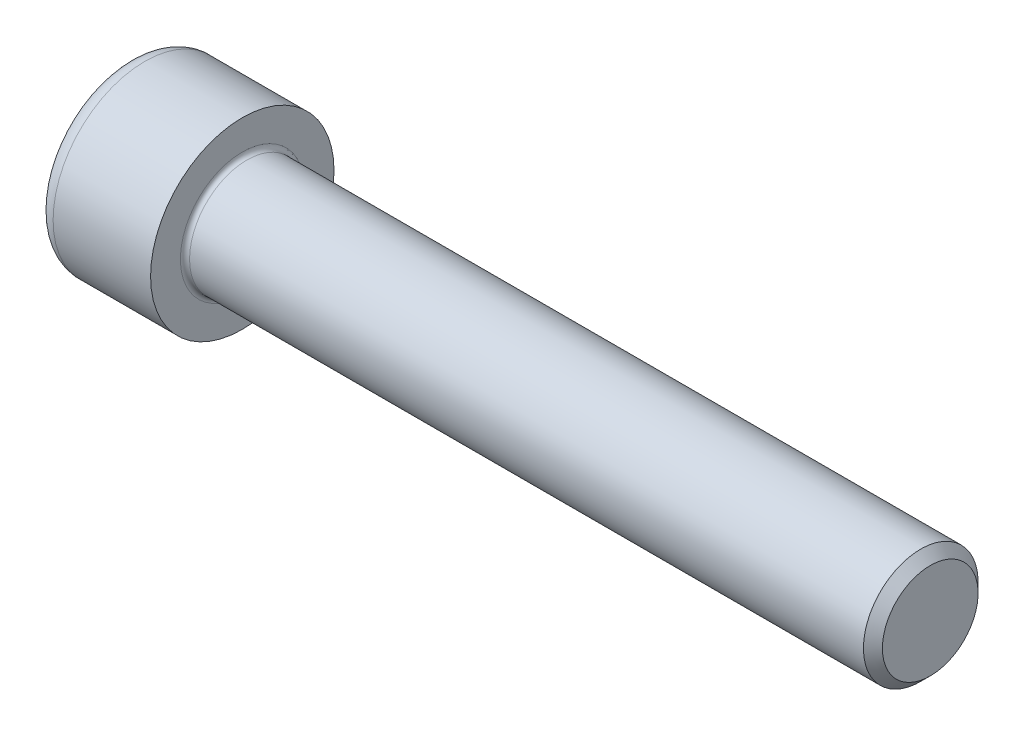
SolidWorks part; units mm, degrees
ref_plane "Plane1" through (0, 0, 0) normal (0, 0, 1) x (1, 0, 0)
ref_plane "Plane2" through (0, 0, 0) normal (0, 1, 0) x (1, 0, 0)
ref_plane "Plane3" through (0, 0, 0) normal (1, 0, 0) x (0, 0, -1)
revolve "Base-Revolve" add sketch "BodySke"
sketch "BodySke" plane through (0, 0, 0) normal (0, 0, 1) x (1, 0, 0)
  line L0 (0, 0) -> (0, 8)
  line L1 (0, 8) -> (10, 8)
  line L2 (10, 8) -> (10, 5)
  line L3 (10, 5) -> (69.172, 5)
  line L4 (70, 4.172) -> (70, 0)
  line L5 (70, 0) -> (0, 0)
  line L6 (-31.75, 0) -> (127, 0) construction
  line L8 (70, 4.172) -> (69.172, 5)
  line L10 (70, -4.172) -> (69.172, -5) construction
  line L11 (11.5, 9.525) -> (11.5, 3.175) construction
  line L12 (10, 9.525) -> (10, 3.175) construction
  line L13 (10, 9.525) -> (10, 3.175) construction
  dimension "Diameter" = 10
  dimension "Head_ht" = 10
  dimension "Length" = 60
  dimension "Body_ch_ang" = 45
  dimension "Head_dia" = 16
  dimension "Minor_dia" = 8.344
  dimension "Advance" = 1.5
  dimension "Thread_nom" = 60
  dimension "Thread_length" = 60
fillet "Fillet1" radius 0.4 1 edges at (10, 0, 5)
fillet "Fillet2" radius 1.5 1 edges at (0, 0, 8)
sketch "Sketch2" plane through (0, 0, 0) normal (0, 0, 1) x (1, 0, 0)
  line L0 (0, 4.0575) -> (5, 4.0575)
  line L1 (5, 4.0575) -> (7.3426, 0)
  line L2 (-31.75, 0) -> (127, 0) construction
  line L3 (7.3426, 0) -> (0, 0)
  line L4 (0, 0) -> (0, 4.0575)
  line L6 (0, 0) -> (47.625, 0) construction
  dimension "D1" = 4.0575
  dimension "D2" = 60
  dimension "Depth" = 5
revolve "Hex-PreBroach" cut sketch "Sketch2" angle 360 about L6
sketch "Sketch3" plane through (0, 0, 0) normal (-1, 0, 0) x (0, 0.5, 0.866)
  line L0 (2.3426, 4.0575) -> (-2.3426, 4.0575)
  line L1 (-2.3426, 4.0575) -> (-4.6852, 0)
  line L2 (2.3426, 4.0575) -> (4.6852, 0)
  line L3 (2.3426, -4.0575) -> (4.6852, 0)
  line L4 (2.3426, -4.0575) -> (-2.3426, -4.0575)
  line L5 (-2.3426, -4.0575) -> (-4.6852, 0)
  dimension "D1" = 4.0575
  dimension "D2" = 4.0575
  dimension "Hex_size" = 8.115
extrude "Hex" cut sketch "Sketch3" against normal blind 5
sketch "ThdSchSke" plane through (0, 0, 0) normal (0, 0, 1) x (1, 0, 0)
  line L0 (14.5, -4.172) -> (13.9202, -5)
  line L1 (14.5, -4.172) -> (15.0798, -5)
  line L2 (15.0798, -5) -> (15.0798, -6.25)
  line L3 (-3.175, 0) -> (5.1513, 0) construction
  line L4 (0, 6.5) -> (0, -6.5) construction
  line L5 (15.0798, -6.25) -> (13.9202, -6.25)
  line L6 (13.9202, -6.25) -> (13.9202, -5)
  dimension "Thread_minor" = 8.344
  dimension "Diameter" = 10
  dimension "Start" = 14.5
  dimension "SideAngle" = 55
  dimension "VeeAngle" = 70
  dimension "Overcut" = 12.5
revolve "ThreadSchematic" [suppressed] cut sketch "ThdSchSke" angle 360 about L3
pattern_linear "ThdSchPat" [suppressed]
equation "\"D2@Sketch3\" = \"Hex_size@Sketch3\" / 2"
equation "\"D1@Sketch3\" = \"Hex_size@Sketch3\" / 2"
equation "\"D1@Sketch2\" = \"Hex_size@Sketch3\" / 2"
equation "\"Thread_minor@ThreadCosmetic\"  =  \"Minor_dia@BodySke\""
equation "\"Depth@Sketch2\" =  \"Key_eng@Hex\""
equation "\"Thread_length@ThreadCosmetic\" = ((sgn( (\"Length@BodySke\" - \"Advance@BodySke\" * 3.0) - \"Thread_nom@BodySke\" )-1)*( (\"Length@BodySke\" - \"Advance@BodySke\" * 3.0) - \"Thread_nom@BodySke\" ))/-2+ \"Thread_no"
equation "\"Thread_minor@ThdSchSke\" = \"Minor_dia@BodySke\""
equation "\"Diameter@ThdSchSke\" = \"Diameter@BodySke\""
equation "\"Overcut@ThdSchSke\" = \"Diameter@BodySke\" * 1.25"
equation "\"Start@ThdSchSke\" = \"Head_ht@BodySke\" + \"Length@BodySke\" - \"Thread_length@ThreadCosmetic\"  '---Non-countersunk---"
equation "\"Num_threads@ThdSchPat\" = int( \"Thread_length@ThreadCosmetic\" / \"Advance@BodySke\" + 0.999 )  + 1"
equation "\"Advance@ThdSchPat\" = \"Thread_length@ThreadCosmetic\" /  (\"Num_threads@ThdSchPat\" - 1) 'relax it"
equation "\"Num_threads@ThdSchPat\" = \"Num_threads@ThdSchPat\" - sgn( \"Num_threads@ThdSchPat\" - 1) '---chamfered tips only---"
